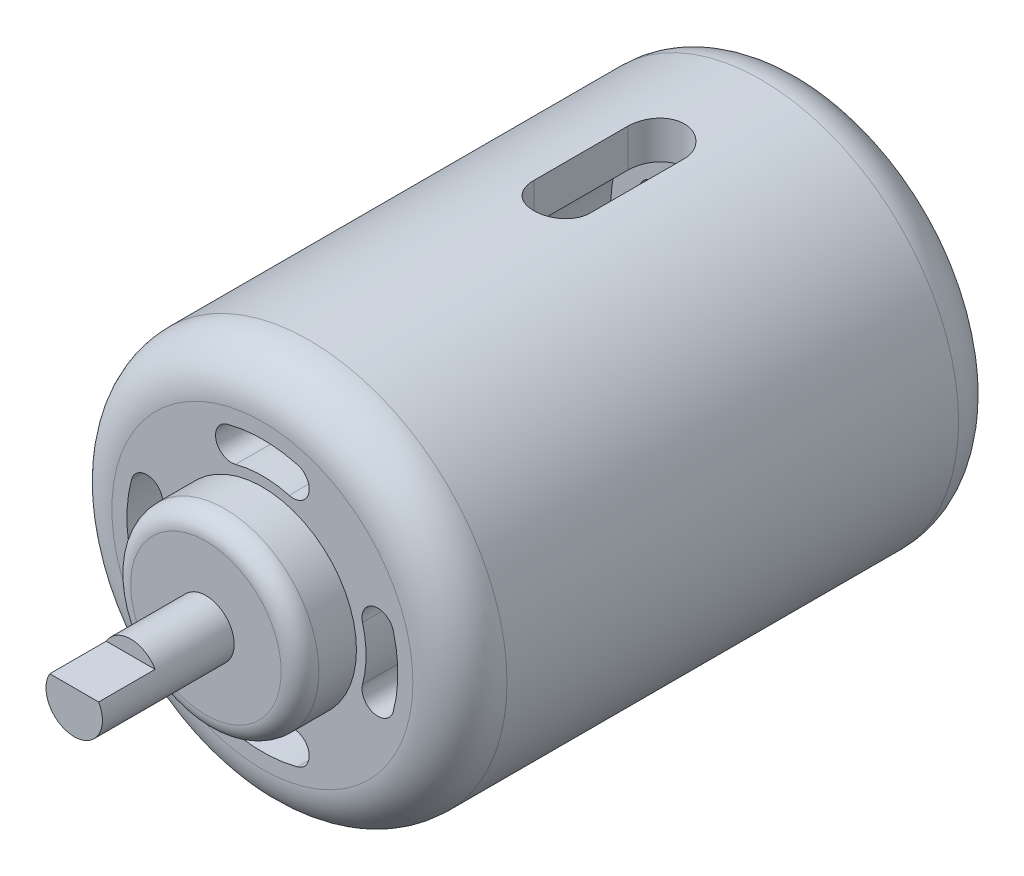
SolidWorks part; units mm, degrees
ref_plane "Plan de face" through (0, 0, 0) normal (0, 0, 1) x (1, 0, 0)
ref_plane "Plan de dessus" through (0, 0, 0) normal (0, 1, 0) x (1, 0, 0)
ref_plane "Plan de droite" through (0, 0, 0) normal (1, 0, 0) x (0, 0, -1)
sketch "Esquisse1" plane through (0, 0, 0) normal (0, 0, 1) x (1, 0, 0)
  circle A0 centre (0, 0) radius 10.5
  dimension "D1" = 21
extrude "Extrusion1" add sketch "Esquisse1" along normal blind 27
sketch "Esquisse2" plane through (0, 0, 27) normal (0, 0, 1) x (1, 0, 0)
  circle A0 centre (0, 0) radius 5
  dimension "D1" = 10
extrude "Extrusion2" add sketch "Esquisse2" along normal blind 3
shell "Coque5" thickness 2
sketch "Esquisse3" plane through (0, 0, 30) normal (0, 0, 1) x (1, 0, 0)
  circle A0 centre (0, 0) radius 1.5
  dimension "D1" = 3
extrude "Extrusion3" add sketch "Esquisse3" along normal blind 7
sketch "Esquisse4" plane through (0, 0, 37) normal (0, 0, 1) x (1, 0, 0)
  line L1 (-1.798, 2.8749) -> (2.2884, 2.8749)
  line L2 (-1.798, 2.8749) -> (-1.798, 0.75)
  line L3 (-1.798, 0.75) -> (2.2884, 0.75)
  line L4 (2.2884, 2.8749) -> (2.2884, 0.75)
  dimension "D1" = 0.75
extrude "Enlèv. mat.-Extru.1" cut sketch "Esquisse4" against normal blind 3
sketch "Esquisse5" plane through (0, 0, 0) normal (0, 1, 0) x (1, 0, 0)
  line L0 (0, 0) -> (0, -24.9176) construction
  line L2 (-1.5, -6.0773) -> (-1.5, -11.0773)
  line L4 (1.5, -6.0773) -> (1.5, -11.0773)
  arc A0 (1.5, -6.0773) -> (-1.5, -6.0773) centre (0, -6.0773) ccw
  arc A1 (-1.5, -11.0773) -> (1.5, -11.0773) centre (0, -11.0773) ccw
  dimension "D1" = 1.5
  dimension "D2" = 3
  dimension "D3" = 5
extrude "Enlèv. mat.-Extru.2" cut sketch "Esquisse5" against normal mid plane 40
sketch "Esquisse6" plane through (0, 0, 0) normal (0, 0, -1) x (-1, 0, 0)
  circle A0 centre (0, 0) radius 10.5
  dimension "D1" = 21
extrude "Extrusion4" add sketch "Esquisse6" along normal blind 2
fillet "Congé3" radius 2.5 2 edges at (-10.5, 0, -2) (10.5, 0, 27)
fillet "Congé4" radius 1 1 edges at (5, 0, 30)
sketch "Esquisse7" plane through (0, 0, 27) normal (0, 0, 1) x (1, 0, 0)
  line L0 (0, 0) -> (-4.1031, 15.3131) construction
  line L1 (0, 0) -> (0, 15.4466) construction
  arc A0 (1.4265, 5.3236) -> (-1.4265, 5.3236) centre (0, 0) ccw
  arc A1 (1.8635, 6.9547) -> (-1.8635, 6.9547) centre (0, 0) ccw
  arc A2 (-1.8635, 6.9547) -> (-1.4265, 5.3236) centre (-1.645, 6.1392) ccw
  arc A3 (1.8635, 6.9547) -> (1.4265, 5.3236) centre (1.645, 6.1392) cw
  arc A4 (5.3236, -1.4265) -> (5.3236, 1.4265) centre (0, 0) ccw
  arc A5 (6.9547, -1.8635) -> (6.9547, 1.8635) centre (0, 0) ccw
  arc A6 (6.9547, 1.8635) -> (5.3236, 1.4265) centre (6.1392, 1.645) ccw
  arc A7 (6.9547, -1.8635) -> (5.3236, -1.4265) centre (6.1392, -1.645) cw
  arc A8 (-1.4265, -5.3236) -> (1.4265, -5.3236) centre (0, 0) ccw
  arc A9 (-1.8635, -6.9547) -> (1.8635, -6.9547) centre (0, 0) ccw
  arc A10 (1.8635, -6.9547) -> (1.4265, -5.3236) centre (1.645, -6.1392) ccw
  arc A11 (-1.8635, -6.9547) -> (-1.4265, -5.3236) centre (-1.645, -6.1392) cw
  arc A12 (-5.3236, 1.4265) -> (-5.3236, -1.4265) centre (0, 0) ccw
  arc A13 (-6.9547, 1.8635) -> (-6.9547, -1.8635) centre (0, 0) ccw
  arc A14 (-6.9547, -1.8635) -> (-5.3236, -1.4265) centre (-6.1392, -1.645) ccw
  arc A15 (-6.9547, 1.8635) -> (-5.3236, 1.4265) centre (-6.1392, 1.645) cw
  dimension "D2" = 7.2
  dimension "D1" = 15
extrude "Enlèv. mat.-Extru.3" cut sketch "Esquisse7" against normal through all
